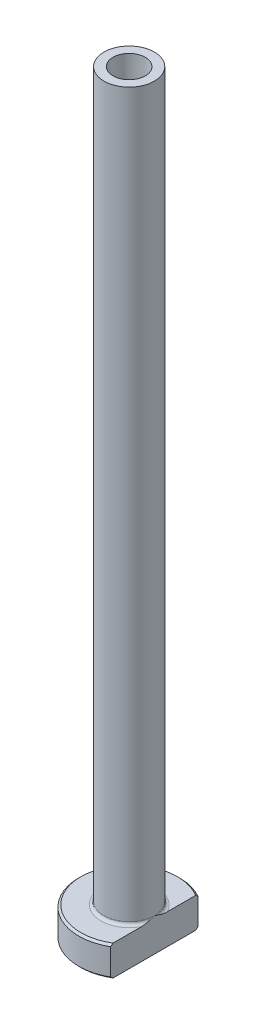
SolidWorks part; units mm, degrees
ref_plane "Front Plane" through (0, 0, 0) normal (0, 0, 1) x (1, 0, 0)
ref_plane "Top Plane" through (0, 0, 0) normal (0, 1, 0) x (1, 0, 0)
ref_plane "Right Plane" through (0, 0, 0) normal (1, 0, 0) x (0, 0, -1)
sketch "Sketch1" plane through (0, 0, 0) normal (0, 0, 1) x (1, 0, 0)
  line L0 (-1.6, 75) -> (-2.5, 75)
  line L1 (-2.5, 75) -> (-2.5, 3)
  line L2 (-2.5, 3) -> (-5, 3)
  line L3 (-5, 3) -> (-5, 0)
  line L4 (4.125, 0) -> (-4.125, 0) construction
  line L5 (-5, 0) -> (-1.85, 0)
  line L6 (-1.6, 30) -> (-1.6, 75)
  line L7 (0, 92.1877) -> (0, -15.5353) construction
  line L8 (0, -5.5) -> (0, 5.5) construction
  line L9 (-1.6, 30) -> (-1.85, 18)
  line L10 (-1.85, 18) -> (-1.85, 0)
  dimension "D1" = 0.25
  dimension "ID" = 3.2
  dimension "OD" = 5
  dimension "L" = 75
  dimension "H" = 10
  dimension "T" = 3
  dimension "N" = 45
  dimension "D2" = 12
  dimension "L-N" = 30
revolve "Revolve1" add sketch "Sketch1" angle 360 about L7
fillet "Fillet1" radius 0.3 1 edges at (0, 3, 2.5)
chamfer "Chamfer1" distance 0.2 angle 45 2 edges at (0, 3, 5) (0, 0, 5)
sketch "Sketch2" plane through (0, 0, 0) normal (0, -1, 0) x (1, 0, 0)
  line L0 (2.5, 4.3301) -> (2.5, -4.3301)
  circle A0 centre (0, 0) radius 5 construction
  arc A1 (2.5, 4.3301) -> (2.5, -4.3301) centre (0, 0) cw
  circle A2 centre (0, 0) radius 2.5 construction
extrude "Cut-Extrude1" cut sketch "Sketch2" against normal through all
chamfer "Chamfer2" distance 0.5 angle 45 1 edges at (0, 0, 1.85)
